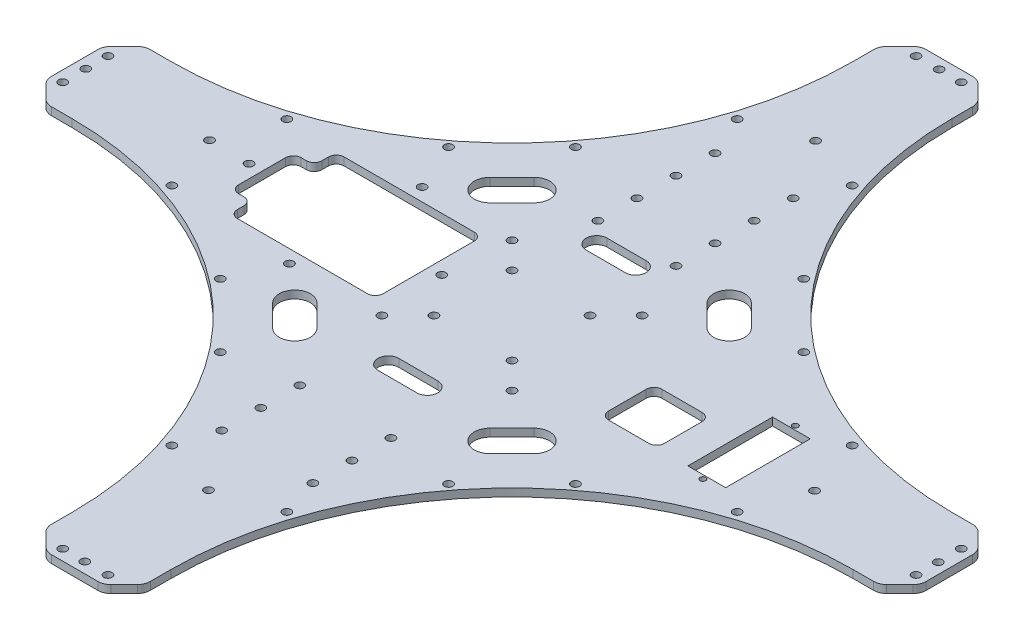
SolidWorks part; units mm, degrees
ref_plane "前视基准面" through (0, 0, 0) normal (0, 0, 1) x (1, 0, 0)
ref_plane "上视基准面" through (0, 0, 0) normal (0, 1, 0) x (1, 0, 0)
ref_plane "右视基准面" through (0, 0, 0) normal (1, 0, 0) x (0, 0, -1)
other "Configuration Table"
sketch "草图1" plane through (0, 0, 0) normal (0, 1, 0) x (1, 0, 0)
  line L0 (0, 0) -> (0, 150) construction
  line L1 (0, 150) -> (150, 150) construction
  line L2 (0, -55) -> (0, 55) construction
  line L3 (-19, 168) -> (-19, 150)
  line L8 (19, 168) -> (19, 150)
  line L9 (-19, 168) -> (19, 168)
  line L10 (-55, 0) -> (55, 0) construction
  line L11 (-19, -168) -> (-19, -150)
  line L12 (-19, -168) -> (19, -168)
  line L13 (19, -168) -> (19, -150)
  line L14 (150, -19) -> (168, -19)
  line L16 (150, 19) -> (168, 19)
  line L17 (168, 19) -> (168, -19)
  line L19 (-168, 19) -> (-168, -19)
  line L20 (-150, 19) -> (-168, 19)
  line L21 (-150, -19) -> (-168, -19)
  line L22 (0, 0) -> (64.835, 0) construction
  line L23 (0, 179.6051) -> (0, -179.6051) construction
  line L24 (0, 179.6051) -> (-179.6051, 0) construction
  line L25 (-179.6051, 0) -> (0, -179.6051) construction
  line L26 (0, -179.6051) -> (179.6051, 0) construction
  line L28 (0, 179.6051) -> (179.6051, 0) construction
  line L29 (0, 0) -> (-95.3414, 0) construction
  circle A28 centre (150, 150) radius 150 construction
  circle A29 centre (-150, 150) radius 150 construction
  arc A30 (19, 150) -> (150, 19) centre (150, 150) ccw
  circle A31 centre (0, 0) radius 39.7722 construction
  arc A32 (19, -150) -> (150, -19) centre (150, -150) cw
  arc A33 (-19, -150) -> (-150, -19) centre (-150, -150) ccw
  arc A34 (-19, 150) -> (-150, 19) centre (-150, 150) cw
  point P10 (168, 0)
  dimension "D1" = 150
  dimension "D7" = 90
  dimension "D2" = 150
  dimension "D3" = 38
  dimension "D6" = 90
  dimension "D4" = 168
  dimension "D5" = 168
  dimension "D8" = 254
extrude "凸台-拉伸1" add sketch "草图1" along normal blind 3
sketch "草图2" plane through (0, 3, 0) normal (0, 1, 0) x (1, 0, 0)
  line L1 (-15, 15) -> (15, 15) construction
  line L2 (-15, 15) -> (-15, -15) construction
  line L3 (-15, -15) -> (15, -15) construction
  line L4 (15, 15) -> (15, -15) construction
  line L5 (-15, 15) -> (15, -15) construction
  line L6 (-15, -15) -> (15, 15) construction
  circle A0 centre (-15, 15) radius 1.6
  circle A1 centre (15, 15) radius 1.6
  circle A2 centre (15, -15) radius 1.6
  circle A3 centre (-15, -15) radius 1.6
  point P0 (0, 0)
  point P10 (0, 0)
  point P13 (0, 0)
  point P16 (0, 0)
  point P19 (0, 0)
  dimension "D3" = 3.2
  dimension "D1" = 30
  dimension "D2" = 30
extrude "分电" cut sketch "草图2" against normal blind 10
sketch "草图3" plane through (0, 3, 0) normal (0, 1, 0) x (1, 0, 0)
  line L1 (-25, 25) -> (25, 25) construction
  line L2 (-25, 25) -> (-25, -25) construction
  line L3 (-25, -25) -> (25, -25) construction
  line L4 (25, 25) -> (25, -25) construction
  line L5 (-25, 25) -> (25, -25) construction
  line L6 (-25, -25) -> (25, 25) construction
  circle A0 centre (-25, 25) radius 1.6
  circle A1 centre (25, 25) radius 1.6
  circle A2 centre (25, -25) radius 1.6
  circle A3 centre (-25, -25) radius 1.6
  point P0 (0, 0)
  point P10 (0, 0)
  point P13 (0, 0)
  point P16 (0, 0)
  point P19 (0, 0)
  dimension "D3" = 3.2
  dimension "D1" = 50
  dimension "D2" = 50
extrude "核心板" cut sketch "草图3" against normal blind 3
sketch "草图4" plane through (0, 3, 0) normal (0, 1, 0) x (1, 0, 0)
  line L0 (-163.9, 12.7999) -> (-163.9, 4.6) construction
  line L1 (-1.65, 0) -> (1.65, 0) construction
  circle A0 centre (-116.4, 0.2) radius 1.6
  circle A1 centre (-163.9, 0.2) radius 1.6
  arc A27 (-165.6, 6.3) -> (-162.2, 6.3) centre (-163.9, 6.3) ccw construction
  circle A28 centre (-163.9, 8.7) radius 1.6
  circle A29 centre (-163.9, -8.7) radius 1.6
  circle A30 centre (8.7, 163.9) radius 1.6
  circle A31 centre (-8.7, 163.9) radius 1.6
  circle A32 centre (163.9, -8.7) radius 1.6
  circle A33 centre (163.9, 8.7) radius 1.6
  circle A34 centre (-8.7, -163.9) radius 1.6
  circle A35 centre (8.7, -163.9) radius 1.6
  circle A36 centre (0.2, 163.9) radius 1.6
  circle A37 centre (0.2, 116.4) radius 1.6
  circle A38 centre (163.9, -0.2) radius 1.6
  circle A39 centre (116.4, -0.2) radius 1.6
  circle A40 centre (-0.2, -163.9) radius 1.6
  circle A41 centre (-0.2, -116.4) radius 1.6
  spline S0 degree 2 poles (-165.6, 11.1) (-165.6, 11.4237) (-165.4806, 11.7257) (-165.3515, 12.0522) (-165.102, 12.302) (-164.854, 12.5504) (-164.5257, 12.6806) (-164.2253, 12.7997) (-163.9, 12.7999) (-163.5767, 12.8001) (-163.2743, 12.6806) (-162.9478, 12.5515) (-162.698, 12.302) (-162.4496, 12.054) (-162.3194, 11.7257) (-162.2001, 11.4248) (-162.2001, 11.1) knots 0 0 0 0.125 0.125 0.25 0.25 0.375 0.375 0.5 0.5 0.625 0.625 0.75 0.75 0.875 0.875 1 1 1 construction
  point P21 (0, 50.949)
  point P35 (0, 0)
  point P48 (0, 0)
  dimension "D1" = 3.2
  dimension "D2" = 3.2
  dimension "D3" = 3.2
  dimension "D4" = 4
  dimension "D5" = 4
extrude "切除-拉伸1" cut sketch "草图4" against normal blind 10
sketch "草图6" plane through (0, 3, 0) normal (0, 1, 0) x (1, 0, 0)
  line L0 (0, 0) -> (0, 179.6051) construction
  line L1 (0, 0) -> (-179.6051, 0) construction
  line L2 (0, 179.6051) -> (-179.6051, 0) construction
  line L3 (179.6051, 0) -> (0, 179.6051) construction
  line L4 (0, -179.6051) -> (179.6051, 0) construction
  line L5 (-179.6051, 0) -> (0, -179.6051) construction
  circle A0 centre (0, 0) radius 9.43 construction
  circle A1 centre (-68.2206, 43.8486) radius 1.6
  circle A2 centre (-108.5747, 22.0967) radius 1.6
  circle A3 centre (-68.2206, -43.8486) radius 1.6
  circle A4 centre (-108.5747, -22.0967) radius 1.6
  circle A5 centre (43.8486, 68.2206) radius 1.6
  circle A6 centre (22.0967, 108.5747) radius 1.6
  circle A7 centre (-22.0967, 108.5747) radius 1.6
  circle A8 centre (-43.8486, 68.2206) radius 1.6
  circle A9 centre (68.2206, -43.8486) radius 1.6
  circle A10 centre (108.5747, -22.0967) radius 1.6
  circle A11 centre (108.5747, 22.0967) radius 1.6
  circle A12 centre (68.2206, 43.8486) radius 1.6
  circle A13 centre (-43.8486, -68.2206) radius 1.6
  circle A14 centre (-22.0967, -108.5747) radius 1.6
  circle A15 centre (22.0967, -108.5747) radius 1.6
  circle A16 centre (43.8486, -68.2206) radius 1.6
  point P13 (0, 0)
  point P47 (0, 0)
  dimension "D3" = 3.2
  dimension "D4" = 3.2
  dimension "D2" = 254
  dimension "D1" = 4
chamfer "倒角1" distance 8 angle 45 8 edges at (19, 1.5, -168) (-19, 1.5, -168) (-168, 1.5, 19) (-168, 1.5, -19) (-19, 1.5, 168) (19, 1.5, 168) (168, 1.5, 19) (168, 1.5, -19)
fillet "圆角1" radius 5 4 edges at (19, 1.5, -160) (11, 1.5, -168) (-19, 1.5, -160) (-11, 1.5, -168)
mirror "镜向4" about plane through (0, 0, 0) normal (0, 0, 1) of "圆角1"
fillet "圆角2" radius 5 4 edges at (-160, 1.5, -19) (-168, 1.5, -11) (-160, 1.5, 19) (-168, 1.5, 11)
mirror "镜向5" about plane through (0, 0, 0) normal (1, 0, 0) of "圆角2"
extrude "切除-拉伸3" cut sketch "草图6" against normal blind 8
sketch "草图7" plane through (0, 3, 0) normal (0, 1, 0) x (1, 0, 0)
  line L0 (-108.5747, 22.0967) -> (-108.5747, -22.0967) construction
sketch "草图8" plane through (0, 3, 0) normal (0, 1, 0) x (1, 0, 0)
  line L0 (0, -1.65) -> (0, 1.65) construction
  line L1 (-16.25, 98.3159) -> (16.25, 98.3159) construction
  line L2 (-16.25, 98.3159) -> (-16.25, 83.8159) construction
  line L3 (-16.25, 83.8159) -> (16.25, 83.8159) construction
  line L4 (16.25, 98.3159) -> (16.25, 83.8159) construction
  line L5 (-16.25, 98.3159) -> (16.25, 83.8159) construction
  line L6 (-16.25, 83.8159) -> (16.25, 98.3159) construction
  line L7 (0, 0) -> (0, 30.7833) construction
  line L8 (98.3159, 16.25) -> (98.3159, -16.25)
  line L9 (83.8159, 16.25) -> (83.8159, -16.25)
  line L10 (98.3159, 16.25) -> (83.8159, 16.25)
  line L11 (98.3159, -16.25) -> (83.8159, -16.25)
  line L12 (16.25, -98.3159) -> (-16.25, -98.3159) construction
  line L13 (16.25, -83.8159) -> (-16.25, -83.8159) construction
  line L14 (16.25, -98.3159) -> (16.25, -83.8159) construction
  line L15 (-16.25, -98.3159) -> (-16.25, -83.8159) construction
  line L16 (-98.3159, -13.25) -> (-98.3159, 16.25) construction
  line L17 (-83.8159, -16.25) -> (-83.8159, 16.25) construction
  line L18 (-95.3159, -16.25) -> (-83.8159, -16.25) construction
  line L19 (-98.3159, 16.25) -> (-83.8159, 16.25) construction
  line L20 (0, 0) -> (-60, 0) construction
  line L21 (68.8159, -16.25) -> (53.3159, -16.25)
  line L22 (71.8159, -13.25) -> (71.8159, 1.25)
  line L23 (68.8159, 4.25) -> (53.3159, 4.25)
  line L24 (50.3159, -13.25) -> (50.3159, 1.25)
  line L25 (-91, 12) -> (-93, 12)
  line L26 (-85, 20.5) -> (-35, 20.5)
  line L27 (-88, 17.5) -> (-88, 15)
  line L28 (-85, -20.5) -> (-35, -20.5)
  line L29 (-32, 17.5) -> (-32, -17.5)
  line L30 (-88, 20.5) -> (-32, -20.5) construction
  line L31 (-88, -20.5) -> (-32, 20.5) construction
  line L32 (-91, -12) -> (-93, -12)
  line L33 (-96, 9) -> (-96, -9)
  line L34 (-88, -15) -> (-88, -17.5)
  line L35 (-96, 0) -> (-101, 0) construction
  line L36 (-60, 20.5) -> (-60, 25.5) construction
  circle A0 centre (-17.75, 91.0659) radius 1.1 construction
  circle A1 centre (17.75, 91.0659) radius 1.1 construction
  circle A2 centre (91.0659, -17.75) radius 1.1
  circle A3 centre (91.0659, 17.75) radius 1.1
  circle A4 centre (-17.75, -91.0659) radius 1.1 construction
  circle A5 centre (17.75, -91.0659) radius 1.1 construction
  circle A6 centre (-91.0659, 17.75) radius 1.1 construction
  circle A7 centre (-91.0659, -17.75) radius 1.1 construction
  arc A8 (53.3159, -16.25) -> (50.3159, -13.25) centre (53.3159, -13.25) cw
  arc A9 (68.8159, -16.25) -> (71.8159, -13.25) centre (68.8159, -13.25) ccw
  arc A10 (71.8159, 1.25) -> (68.8159, 4.25) centre (68.8159, 1.25) ccw
  arc A11 (53.3159, 4.25) -> (50.3159, 1.25) centre (53.3159, 1.25) ccw
  arc A12 (-98.3159, -13.25) -> (-95.3159, -16.25) centre (-95.3159, -13.25) ccw construction
  arc A13 (-93, 12) -> (-96, 9) centre (-93, 9) ccw
  arc A14 (-93, -12) -> (-96, -9) centre (-93, -9) cw
  arc A15 (-91, 12) -> (-88, 15) centre (-91, 15) ccw
  arc A16 (-91, -12) -> (-88, -15) centre (-91, -15) cw
  arc A17 (-88, -17.5) -> (-85, -20.5) centre (-85, -17.5) ccw
  arc A18 (-35, -20.5) -> (-32, -17.5) centre (-35, -17.5) ccw
  arc A19 (-35, 20.5) -> (-32, 17.5) centre (-35, 17.5) cw
  arc A20 (-85, 20.5) -> (-88, 17.5) centre (-85, 17.5) ccw
  circle A21 centre (-101, 0) radius 1.6
  circle A22 centre (-60, 25.5) radius 1.6
  circle A23 centre (-60, -25.5) radius 1.6
  circle A24 centre (-27, 0) radius 1.6
  point P0 (0, 91.0659)
  point P41 (0, 0)
  point P43 (-60, 0)
  point P65 (-96, 12)
  point P68 (-96, -12)
  point P71 (-88, 12)
  point P74 (-88, -12)
  dimension "D3" = 2.2
  dimension "D9" = 3
  dimension "D15" = 3
  dimension "D16" = 3
  dimension "D17" = 3
  dimension "D19" = 3.2
  dimension "D20" = 3.2
  dimension "D22" = 3.2
  dimension "D1" = 32.5
  dimension "D2" = 14.5
  dimension "D4" = 35.5
  dimension "D6" = 21.5
  dimension "D7" = 20.5
  dimension "D8" = 12
  dimension "D10" = 41
  dimension "D11" = 56
  dimension "D12" = 60
  dimension "D13" = 8
  dimension "D14" = 24
  dimension "D18" = 5
  dimension "D21" = 5
  dimension "D23" = 5
  dimension "D5" = 4
extrude "切除-拉伸4" cut sketch "草图8" against normal blind 10
sketch "草图9" plane through (0, 3, 0) normal (0, 1, 0) x (1, 0, 0)
  line L0 (-45.9619, 37.4767) -> (-37.4767, 45.9619) construction
  line L1 (-50.2046, 41.7193) -> (-41.7193, 50.2046)
  line L2 (-41.7193, 33.234) -> (-33.234, 41.7193)
  line L3 (0, 0) -> (-9.1828, 0) construction
  line L4 (0, 0) -> (-57.369, 57.369) construction
  line L5 (-41.7193, 41.7193) -> (-29.2168, 54.2218) construction
  line L6 (-41.7193, -41.7193) -> (-29.2168, -54.2218) construction
  line L7 (-45.9619, -37.4767) -> (-37.4767, -45.9619) construction
  line L8 (-50.2046, -41.7193) -> (-41.7193, -50.2046)
  line L9 (-41.7193, -33.234) -> (-33.234, -41.7193)
  line L10 (0, -1.65) -> (0, 1.65) construction
  line L11 (41.7193, -41.7193) -> (29.2168, -54.2218) construction
  line L12 (45.9619, -37.4767) -> (37.4767, -45.9619) construction
  line L13 (50.2046, -41.7193) -> (41.7193, -50.2046)
  line L14 (41.7193, -33.234) -> (33.234, -41.7193)
  line L15 (45.9619, 37.4767) -> (37.4767, 45.9619) construction
  line L16 (50.2046, 41.7193) -> (41.7193, 50.2046)
  line L17 (41.7193, 33.234) -> (33.234, 41.7193)
  line L18 (-7.5, 40) -> (7.5, 40) construction
  line L19 (-7.5, 44) -> (7.5, 44)
  line L20 (-7.5, 36) -> (7.5, 36)
  line L21 (0, 0) -> (0, 13.8458) construction
  line L22 (-7.5, -40) -> (7.5, -40) construction
  line L23 (-7.5, -44) -> (7.5, -44)
  line L24 (-7.5, -36) -> (7.5, -36)
  line L25 (-17.5, -79) -> (17.5, -79) construction
  line L26 (-17.5, -94) -> (17.5, -94) construction
  line L27 (-17.5, -64) -> (17.5, -64) construction
  circle A0 centre (-17.5, -79) radius 1.6
  circle A1 centre (-15, 63) radius 1.6
  circle A2 centre (17.5, -79) radius 1.6
  circle A3 centre (15, 63) radius 1.6
  arc A5 (-50.2046, 41.7193) -> (-41.7193, 33.234) centre (-45.9619, 37.4767) ccw
  arc A6 (-33.234, 41.7193) -> (-41.7193, 50.2046) centre (-37.4767, 45.9619) ccw
  arc A7 (-150, 19) -> (-19, 150) centre (-150, 150) ccw construction
  arc A8 (-50.2046, -41.7193) -> (-41.7193, -33.234) centre (-45.9619, -37.4767) cw
  arc A9 (-33.234, -41.7193) -> (-41.7193, -50.2046) centre (-37.4767, -45.9619) cw
  arc A10 (50.2046, -41.7193) -> (41.7193, -33.234) centre (45.9619, -37.4767) ccw
  arc A11 (33.234, -41.7193) -> (41.7193, -50.2046) centre (37.4767, -45.9619) ccw
  arc A12 (50.2046, 41.7193) -> (41.7193, 33.234) centre (45.9619, 37.4767) cw
  arc A13 (33.234, 41.7193) -> (41.7193, 50.2046) centre (37.4767, 45.9619) cw
  arc A14 (-7.5, 44) -> (-7.5, 36) centre (-7.5, 40) ccw
  arc A15 (7.5, 36) -> (7.5, 44) centre (7.5, 40) ccw
  arc A16 (-7.5, -44) -> (-7.5, -36) centre (-7.5, -40) cw
  arc A17 (7.5, -36) -> (7.5, -44) centre (7.5, -40) cw
  circle A18 centre (-17.5, -64) radius 1.6
  circle A19 centre (17.5, -64) radius 1.6
  circle A20 centre (-17.5, -94) radius 1.6
  circle A21 centre (17.5, -94) radius 1.6
  point P14 (-41.7193, 41.7193)
  point P30 (41.7193, 41.7193)
  point P35 (-41.7193, -41.7193)
  point P47 (41.7193, -41.7193)
  point P57 (0, 40)
  point P66 (0, -40)
  dimension "D1" = 3.2
  dimension "D2" = 3.2
  dimension "D3" = 3.2
  dimension "D4" = 3.2
  dimension "D6" = 6
  dimension "D5" = 90
  dimension "D7" = 12
  dimension "D8" = 65
  dimension "D9" = 8
  dimension "D10" = 15
  dimension "D11" = 40
  dimension "D12" = 15
  dimension "D13" = 15
extrude "切除-拉伸5" cut sketch "草图9" against normal blind 10
sketch "草图10" plane through (0, 3, 0) normal (0, 1, 0) x (1, 0, 0)
  line L0 (0, 0) -> (0, 25.0886) construction
  line L1 (-15, 78) -> (15, 78) construction
  line L2 (-15, 78) -> (-15, 48) construction
  line L3 (-15, 48) -> (15, 48) construction
  line L4 (15, 78) -> (15, 48) construction
  line L5 (-15, 78) -> (15, 48) construction
  line L6 (-15, 48) -> (15, 78) construction
  line L7 (16.6, 63) -> (9.0279, 63) construction
  line L8 (-15, 93) -> (15, 93) construction
  line L9 (0, 0) -> (15, 0) construction
  circle A0 centre (-15, 78) radius 1.6
  circle A1 centre (-15, 48) radius 1.6
  circle A2 centre (15, 48) radius 1.6
  circle A3 centre (15, 78) radius 1.6
  circle A4 centre (15, 63) radius 1.6 construction
  circle A5 centre (-15, 93) radius 1.6
  circle A6 centre (15, 93) radius 1.6
  point P0 (0, 63)
  dimension "D3" = 3.2
  dimension "D4" = 3.2
  dimension "D6" = 3.2
  dimension "D7" = 3.2
  dimension "D1" = 30
  dimension "D2" = 30
  dimension "D5" = 15
extrude "切除-拉伸6" cut sketch "草图10" against normal blind 10
